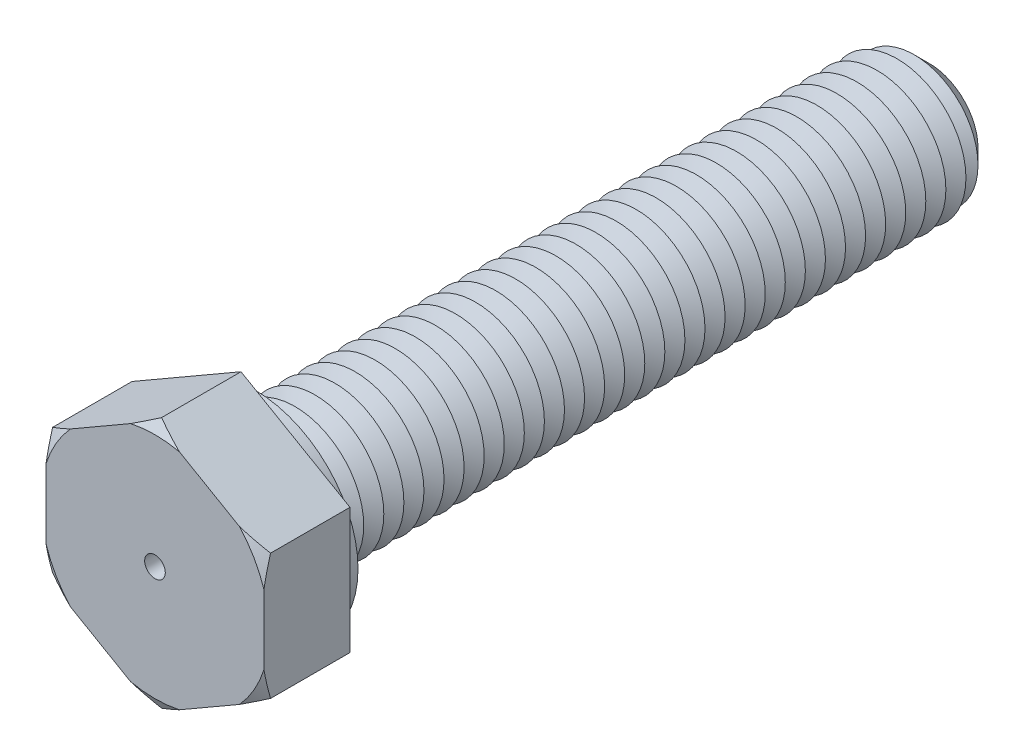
SolidWorks part; units mm, degrees
ref_plane "Front Plane" through (0, 0, 0) normal (0, 0, 1) x (1, 0, 0)
ref_plane "Top Plane" through (0, 0, 0) normal (0, 1, 0) x (1, 0, 0)
ref_plane "Right Plane" through (0, 0, 0) normal (1, 0, 0) x (0, 0, -1)
sketch "Sketch2" plane through (0, 0, 0) normal (0, 0, 1) x (1, 0, 0)
  line L1 (0, 10.9697) -> (-9.5, 5.4848)
  line L2 (-9.5, 5.4848) -> (-9.5, -5.4848)
  line L3 (-9.5, -5.4848) -> (0, -10.9697)
  line L4 (0, -10.9697) -> (9.5, -5.4848)
  line L5 (9.5, -5.4848) -> (9.5, 5.4848)
  line L6 (9.5, 5.4848) -> (0, 10.9697)
  circle A0 centre (0, 0) radius 9.5 construction
  dimension "D1" = 19
extrude "Boss-Extrude1" add sketch "Sketch2" along normal blind 7.5
sketch "Sketch3" plane through (0, 0, 0) normal (0, 0, -1) x (-1, 0, 0)
  circle A0 centre (0, 0) radius 6
  dimension "D1" = 12
extrude "Boss-Extrude2" add sketch "Sketch3" along normal blind 60
sketch "Sketch4" plane through (0, 0, 0) normal (0, 0, -1) x (-1, 0, 0)
  circle A0 centre (0, 0) radius 9
  dimension "D1" = 18
extrude "Boss-Extrude3" add sketch "Sketch4" along normal blind 1.2
sketch "Sketch5" plane through (0, 0, 0) normal (1, 0, 0) x (0, 0, -1)
  line L0 (-3.2117, 0) -> (6.3192, 0) construction
chamfer "Chamfer1" distance 1.75 angle 45 1 edges at (-6, 0, -60)
sketch "Sketch6" plane through (0, 0, 0) normal (1, 0, 0) x (0, 0, -1)
  line L0 (1.2, 6) -> (2.075, 4.4845)
  line L1 (2.075, 4.4845) -> (2.95, 6)
  line L2 (58.25, 6) -> (1.2, 6) construction
  line L3 (2.95, 6) -> (1.2, 6)
  dimension "D1" = 1.75
revolve "Cut-Revolve1" cut sketch "Sketch6" angle 360 about L0
pattern_linear "LPattern1" count 33 spacing 1.75 along (0, 0, -1) of "Cut-Revolve1"
sketch "Sketch7" plane through (0, 0, 0) normal (1, 0, 0) x (0, 0, -1)
  line L0 (-7.5, 10.9697) -> (-7.5, 9.9697)
  line L1 (-7.5, 5.4848) -> (-7.5, 10.9697) construction
  line L2 (-7.5, 9.9697) -> (-6.9226, 10.9697)
  line L3 (-7.5, 10.9697) -> (0, 10.9697) construction
  line L4 (-6.9226, 10.9697) -> (-7.5, 10.9697)
  dimension "D1" = 1
  dimension "D2" = 30
revolve "Cut-Revolve2" cut sketch "Sketch7" angle 360 about L0
sketch "Sketch8" plane through (0, 0, 7.5) normal (0, 0, 1) x (1, 0, 0)
  circle A0 centre (0, 0) radius 0.9
  dimension "D1" = 1.8
extrude "Cut-Extrude1" cut sketch "Sketch8" against normal up to surface (67.5 mm away)
